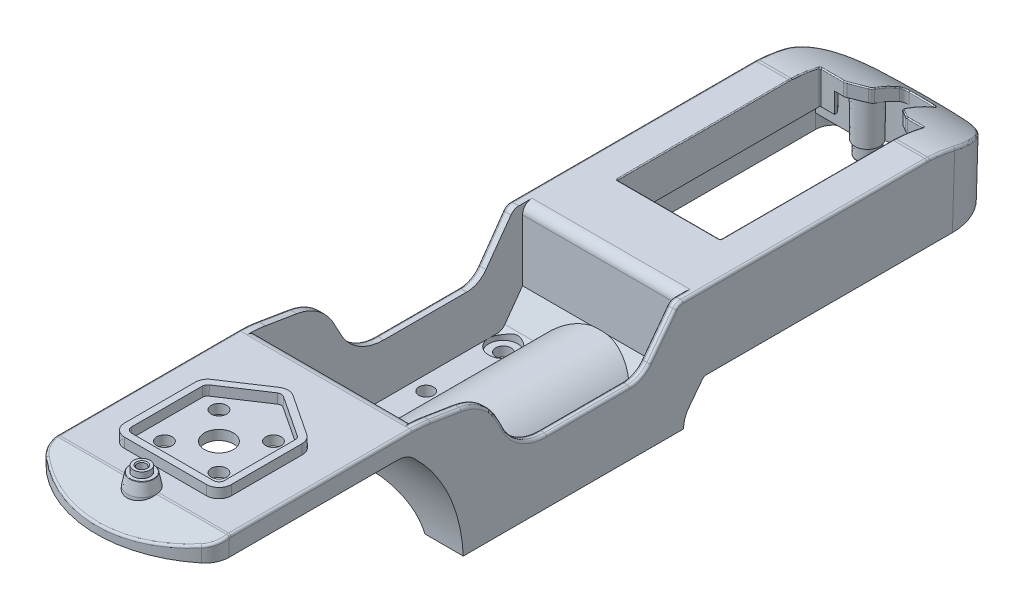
SolidWorks part; units mm, degrees
other "Solido1"
ref_plane "前视基准面" through (0, 0, 0) normal (0, 0, 1) x (1, 0, 0)
ref_plane "上视基准面" through (0, 0, 0) normal (0, 1, 0) x (1, 0, 0)
ref_plane "右视基准面" through (0, 0, 0) normal (1, 0, 0) x (0, 0, -1)
imported_body "Imported1"
other "移动面1" parameters "D1"=0.15
other "移动面2" parameters "D1"=0.15
other "移动面4" parameters "D1"=0.15
fillet "Fillet1" radius 0.5 3 edges
